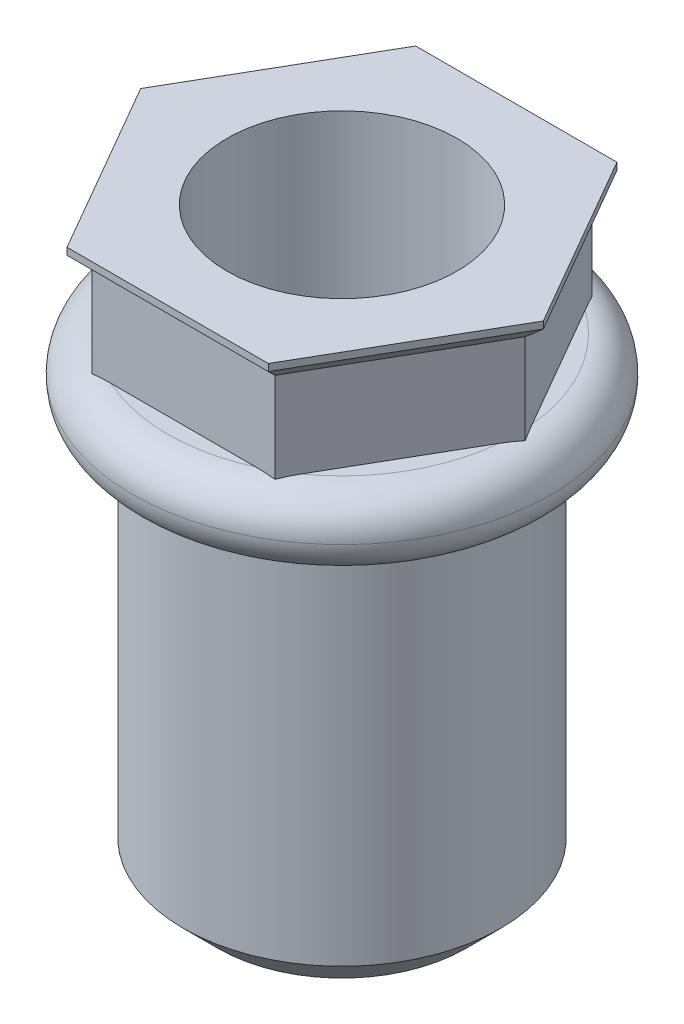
SolidWorks part; units mm, degrees
ref_plane "Plan de face" through (0, 0, 0) normal (0, 0, 1) x (1, 0, 0)
ref_plane "Plan de dessus" through (0, 0, 0) normal (0, 1, 0) x (1, 0, 0)
ref_plane "Plan de droite" through (0, 0, 0) normal (1, 0, 0) x (0, 0, -1)
sketch "Esquisse1" plane through (0, 0, 0) normal (0, 1, 0) x (1, 0, 0)
  circle A0 centre (0, 0) radius 4.55
  dimension "D1" = 9.1
extrude "Extrusion1" add sketch "Esquisse1" along normal blind 11.5
chamfer "Chanfrein1" distance 1 angle 45 1 edges at (0, 0, 4.55)
sketch "Esquisse2" plane through (0, 11.5, 0) normal (0, 1, 0) x (1, 0, 0)
  circle A0 centre (0, 0) radius 6
  dimension "D1" = 12
extrude "Extrusion2" add sketch "Esquisse2" along normal blind 2
fillet "Congé1" radius 1 2 edges at (0, 13.5, 6) (0, 11.5, 6)
ref_plane "Plan1" through (0, 16.7, 0) normal (0, 1, 0) x (-1, 0, 0)
sketch "Esquisse3" plane through (0, 16.7, 0) normal (0, 1, 0) x (-1, 0, 0)
  line L1 (-2.8868, 5) -> (-5.7735, 0)
  line L2 (-5.7735, 0) -> (-2.8868, -5)
  line L3 (-2.8868, -5) -> (2.8868, -5)
  line L4 (2.8868, -5) -> (5.7735, 0)
  line L5 (5.7735, 0) -> (2.8868, 5)
  line L6 (2.8868, 5) -> (-2.8868, 5)
  circle A0 centre (0, 0) radius 5 construction
  dimension "D1" = 10
extrude "Extrusion3" add sketch "Esquisse3" against normal blind 0.65 separate body
chamfer "Chanfrein2" distance 0.45 angle 45 6 edges at (4.3301, 16.05, -2.5) (0, 16.05, -5) (-4.3301, 16.05, -2.5) (-4.3301, 16.05, 2.5) (4.3301, 16.05, 2.5) (0, 16.05, 5)
sketch "Esquisse4" plane through (0, 16.05, 0) normal (0, -1, 0) x (1, 0, 0)
  line L6 (-2.6269, -4.55) -> (2.6269, -4.55)
  line L7 (2.6269, -4.55) -> (5.2539, 0)
  line L8 (5.2539, 0) -> (2.6269, 4.55)
  line L9 (2.6269, 4.55) -> (-2.6269, 4.55)
  line L10 (-2.6269, 4.55) -> (-5.2539, 0)
  line L11 (-5.2539, 0) -> (-2.6269, -4.55)
  line L12 (-2.6269, -4.55) -> (2.6269, -4.55)
  line L13 (2.6269, -4.55) -> (5.2539, 0)
  line L14 (5.2539, 0) -> (2.6269, 4.55)
  line L15 (2.6269, 4.55) -> (-2.6269, 4.55)
  line L16 (-2.6269, 4.55) -> (-5.2539, 0)
  line L17 (-5.2539, 0) -> (-2.6269, -4.55)
  dimension "D1" = 0
extrude "Extrusion4" add sketch "Esquisse4" along normal up to next
hole_wizard "Dégagement M61" positions "Esquisse3D1" profile "Esquisse5" hole size "M6" standard "ISO"
sketch3d "Esquisse3D1"
  circle A0 centre (0, 12.5, 0) radius 6 construction
  point P0 (0, 16.7, 0)
  point P7 (0, 18.5, 0)
sketch "Esquisse5" plane through (0, 16.7, 0) normal (1, 0, 0) x (0, 0, 1)
  line L0 (0, 0) -> (0, 16.6828)
  line L1 (0, 16.6828) -> (3.3, 14.7)
  line L2 (3.3, 14.7) -> (3.3, 0)
  line L5 (3.3, 0) -> (0, 0)
  line L10 (0, 16.6828) -> (-3.3, 14.7) construction
  line L11 (0, -6.35) -> (0, 107.95) construction
  dimension "Diamètre du perçage" = 6.6
  dimension "Profondeur du perçage" = 14.7
  dimension "Angle de pointe" = 118
